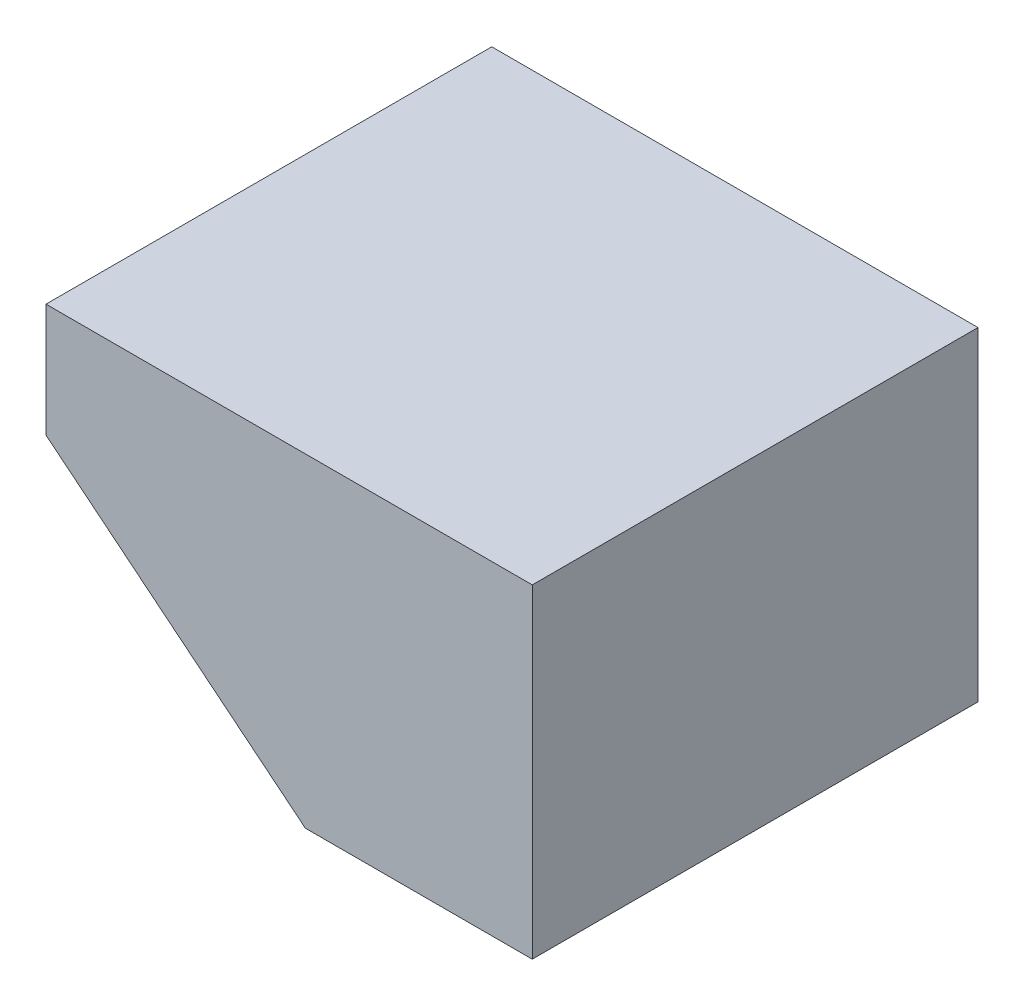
SolidWorks part; units mm, degrees
ref_plane "前视基准面" through (0, 0, 0) normal (0, 0, 1) x (1, 0, 0)
ref_plane "上视基准面" through (0, 0, 0) normal (0, 1, 0) x (1, 0, 0)
ref_plane "右视基准面" through (0, 0, 0) normal (1, 0, 0) x (0, 0, -1)
sketch "草图1" plane through (0, 0, 0) normal (0, 0, 1) x (1, 0, 0)
  line L1 (0, 0) -> (-60, 0)
  line L2 (0, 0) -> (0, 40)
  line L3 (0, 40) -> (-60, 40)
  line L4 (-60, 0) -> (-60, 40)
  dimension "D1" = 60
  dimension "D2" = 40
extrude "拉伸1" add sketch "草图1" along normal blind 55
sketch "草图2" plane through (0, 0, 55) normal (0, 0, 1) x (1, 0, 0)
  line L0 (-60, 26) -> (-28, 0)
  line L1 (-60, 0) -> (-28, 0)
  line L2 (-60, 0) -> (-60, 26)
  dimension "D1" = 26
  dimension "D2" = 32
extrude "切除-拉伸1" cut sketch "草图2" against normal blind 25
